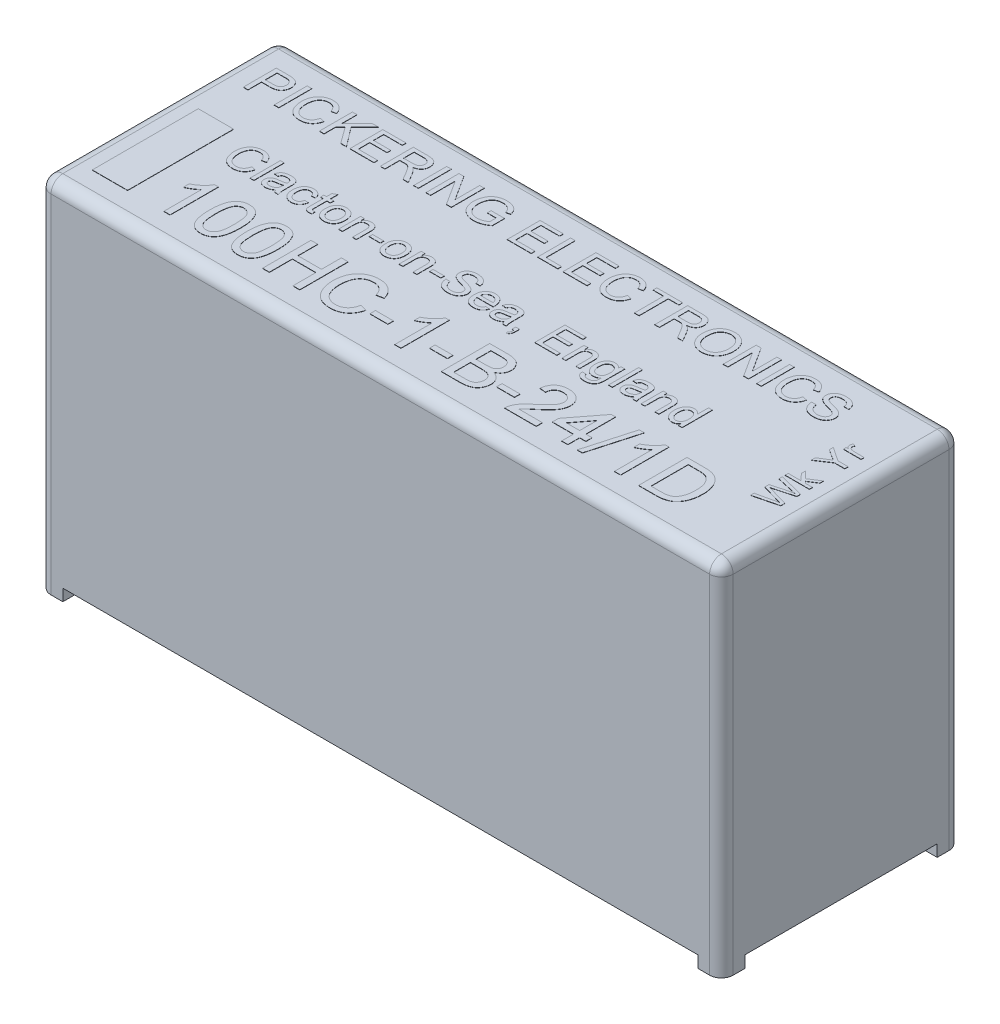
SolidWorks part; units mm, degrees
ref_plane "Front Plane" through (0, 0, 0) normal (0, 0, 1) x (1, 0, 0)
ref_plane "Top Plane" through (0, 0, 0) normal (0, 1, 0) x (1, 0, 0)
ref_plane "Right Plane" through (0, 0, 0) normal (1, 0, 0) x (0, 0, -1)
sketch "Sketch1" plane through (0, 0, 0) normal (0, 1, 0) x (1, 0, 0)
  line L1 (-14.478, -5.08) -> (14.478, -5.08)
  line L2 (-14.478, -5.08) -> (-14.478, 5.08)
  line L3 (-14.478, 5.08) -> (14.478, 5.08)
  line L4 (14.478, -5.08) -> (14.478, 5.08)
  line L5 (-14.478, -5.08) -> (14.478, 5.08) construction
  line L6 (-14.478, 5.08) -> (14.478, -5.08) construction
  point P0 (0, 0)
  dimension "D1" = 28.956
  dimension "D2" = 10.16
extrude "Boss-Extrude1" add sketch "Sketch1" along normal blind 15.24
sketch "Sketch2" plane through (0, 0, 5.08) normal (0, 0, 1) x (1, 0, 0)
  line L0 (-14.478, 0) -> (14.478, 0) construction
  line L1 (-13.478, 0) -> (13.478, 0)
  line L2 (-13.478, 0) -> (-13.478, 0.5)
  line L3 (-13.478, 0.5) -> (13.478, 0.5)
  line L4 (13.478, 0) -> (13.478, 0.5)
  line L5 (-14.478, 15.24) -> (-14.478, 0) construction
  line L6 (14.478, 15.24) -> (14.478, 0) construction
  dimension "D1" = 1
  dimension "D2" = 1
  dimension "D3" = 0.5
extrude "Cut-Extrude1" cut sketch "Sketch2" against normal through all
sketch "Sketch3" plane through (14.478, 0, 0) normal (1, 0, 0) x (0, 0, -1)
  line L0 (-5.08, 0) -> (5.08, 0) construction
  line L1 (-4.08, 0) -> (4.08, 0)
  line L2 (-4.08, 0) -> (-4.08, 0.5)
  line L3 (-4.08, 0.5) -> (4.08, 0.5)
  line L4 (4.08, 0) -> (4.08, 0.5)
  line L5 (-5.08, 15.24) -> (-5.08, 0) construction
  line L6 (5.08, 15.24) -> (5.08, 0) construction
  dimension "D1" = 1
  dimension "D2" = 1
  dimension "D3" = 0.5
extrude "Cut-Extrude2" cut sketch "Sketch3" against normal through all
sketch "Sketch4" plane through (0, 0.5, 0) normal (0, -1, 0) x (1, 0, 0)
  line L0 (-14.478, 0) -> (14.478, 0) construction
  line L1 (-14.478, -4.08) -> (-14.478, 4.08) construction
  line L2 (14.478, -4.08) -> (14.478, 4.08) construction
  line L4 (13.478, 5.08) -> (-13.478, 5.08) construction
  line L5 (0, 5.08) -> (0, -5.08) construction
  line L6 (13.478, -5.08) -> (-13.478, -5.08) construction
  line L7 (-2.8, -0.125) -> (-2.3, -0.125)
  line L8 (-2.8, -0.125) -> (-2.8, 0.125)
  line L9 (-2.8, 0.125) -> (-2.3, 0.125)
  line L10 (-2.3, -0.125) -> (-2.3, 0.125)
  line L11 (-2.8, -0.125) -> (-2.3, 0.125) construction
  line L12 (-2.8, 0.125) -> (-2.3, -0.125) construction
  line L13 (-7.9, -0.125) -> (-7.4, -0.125)
  line L14 (-7.9, -0.125) -> (-7.9, 0.125)
  line L15 (-7.9, 0.125) -> (-7.4, 0.125)
  line L16 (-7.4, -0.125) -> (-7.4, 0.125)
  line L17 (-7.9, -0.125) -> (-7.4, 0.125) construction
  line L18 (-7.9, 0.125) -> (-7.4, -0.125) construction
  line L19 (2.3, -0.125) -> (2.8, -0.125)
  line L20 (2.3, -0.125) -> (2.3, 0.125)
  line L21 (2.3, 0.125) -> (2.8, 0.125)
  line L22 (2.8, -0.125) -> (2.8, 0.125)
  line L23 (2.3, -0.125) -> (2.8, 0.125) construction
  line L24 (2.3, 0.125) -> (2.8, -0.125) construction
  line L25 (7.4, -0.125) -> (7.9, -0.125)
  line L26 (7.4, -0.125) -> (7.4, 0.125)
  line L27 (7.4, 0.125) -> (7.9, 0.125)
  line L28 (7.9, -0.125) -> (7.9, 0.125)
  line L29 (7.4, -0.125) -> (7.9, 0.125) construction
  line L30 (7.4, 0.125) -> (7.9, -0.125) construction
  point P6 (-2.55, 0)
  point P17 (-7.65, 0)
  point P22 (2.55, 0)
  point P27 (7.65, 0)
  dimension "D1" = 5.1
  dimension "D2" = 5.1
  dimension "D3" = 5.1
  dimension "D4" = 0.5
  dimension "D5" = 0.25
extrude "Boss-Extrude2" add sketch "Sketch4" along normal blind 3.6854 separate body
fillet "Fillet2" radius 0.5 4 edges at (0, 15.24, 5.08) (-14.478, 15.24, 0) (0, 15.24, -5.08) (14.478, 15.24, 0)
fillet "Fillet3" radius 0.5 8 edges at (-14.3316, 15.0936, -4.9336) (14.3316, 15.0936, -4.9336) (14.3316, 15.0936, 4.9336) (-14.3316, 15.0936, 4.9336) (-14.478, 7.37, -5.08) (14.478, 7.37, -5.08) (14.478, 7.37, 5.08) (-14.478, 7.37, 5.08)
sketch "Sketch5" plane through (0, 15.24, 0) normal (0, 1, 0) x (1, 0, 0)
  line L0 (-13.478, 2.42) -> (10.7486, 2.42) construction
  line L1 (-11.228, -0.78) -> (8.6555, -0.78) construction
  line L2 (-11.228, -3.83) -> (12.0348, -3.83) construction
  line L3 (13.978, -5.08) -> (-13.978, -5.08) construction
  line L4 (-13.478, 0.67) -> (-11.978, 0.67)
  line L5 (-13.478, 0.67) -> (-13.478, -3.83)
  line L6 (-13.478, -3.83) -> (-11.978, -3.83)
  line L7 (-11.978, 0.67) -> (-11.978, -3.83)
  line L8 (-14.478, -4.58) -> (-14.478, 4.58) construction
  line L9 (13.478, -1.83) -> (13.478, 2.742) construction
  line L10 (14.478, 4.58) -> (14.478, -4.58) construction
  text T0 "PICKERING ELECTRONICS" font "Arial" height 1.4
  text T1 "Clacton-on-Sea, England" font "Arial" height in points 5
  text T2 "100HC-1-B-24/1D" font "Arial" height in points 8
  text T3 "Wk Yr" font "Arial" height in points 4
  dimension "D1" = 4.5
  dimension "D2" = 1.5
  dimension "D3" = 1.25
  dimension "D4" = 1
  dimension "D5" = 1.25
  dimension "D6" = 4.3
  dimension "D7" = 7.5
  dimension "D8" = 3.25
  dimension "D9" = 3.25
  dimension "D10" = 3.25
  dimension "D11" = 1
extrude "Print Details" add sketch "Sketch5" along normal blind 0.01 separate body
equation "\"1.251.20mm\"=1.2"
